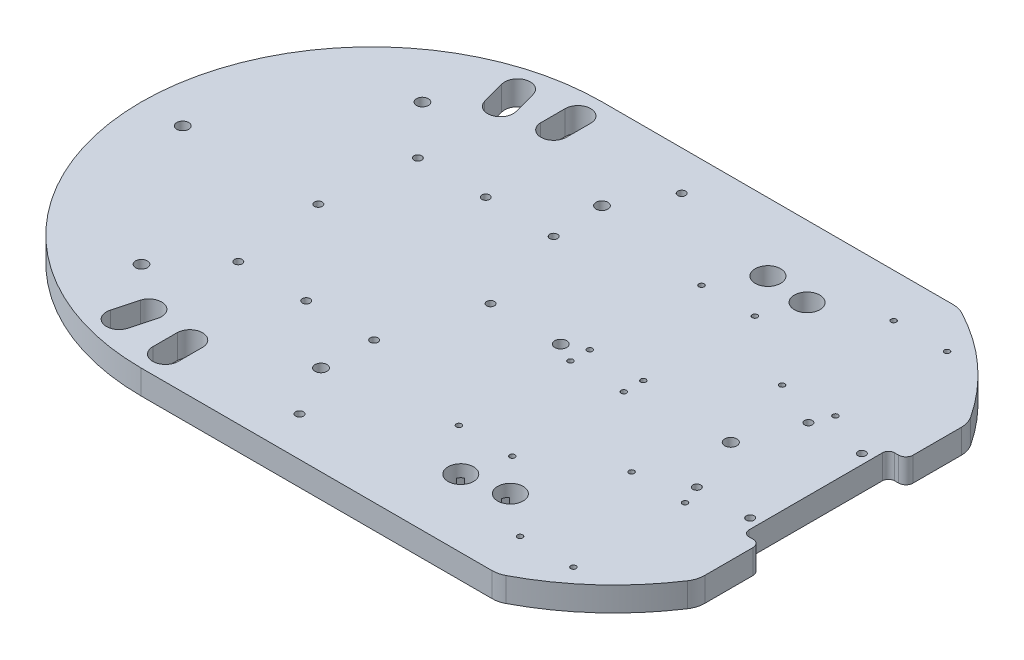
SolidWorks part; units mm, degrees
ref_plane "Plan de face" through (0, 0, 0) normal (0, 0, 1) x (1, 0, 0)
ref_plane "Plan de dessus" through (0, 0, 0) normal (0, 1, 0) x (1, 0, 0)
ref_plane "Plan de droite" through (0, 0, 0) normal (1, 0, 0) x (0, 0, -1)
sketch "Esquisse1" plane through (0, 0, 0) normal (0, 1, 0) x (1, 0, 0)
  line L0 (-177.9243, 0) -> (224.6136, 0) construction
  line L1 (0, -128.8397) -> (0, 232.2214) construction
  line L2 (-50, 153.4637) -> (-50, -108.2097) construction
  line L3 (-145, 153.4637) -> (-145, -16.1078) construction
  line L4 (-296.5055, -95) -> (165.0329, -95) construction
  line L5 (-296.5055, 95) -> (153.3586, 95) construction
  line L6 (-27.4378, -125) -> (224.6136, -125) construction
  line L7 (-16.4403, 125) -> (224.6136, 125) construction
  line L8 (50, 171.1415) -> (50, -142.5611) construction
  line L9 (145, 153.4637) -> (145, -16.1078) construction
  line L10 (175, 232.2214) -> (175, -16.1078) construction
  line L11 (140.1388, 52.8562) -> (140.1388, 32.9993)
  line L12 (-6, -128.8397) -> (-6, 131.9546) construction
  line L13 (-55.2475, -84.8379) -> (-55.2468, -74.8162)
  line L14 (140.1388, -52.8562) -> (140.1388, -32.9993)
  line L15 (-26, 113.4729) -> (-26, -11.8602) construction
  line L16 (-44.7532, -74.8163) -> (-44.7525, -84.8379)
  line L17 (-77.0263, -80.5889) -> (-74.4319, -70.909)
  line L18 (-64.2959, -73.6249) -> (-66.889, -83.3052)
  line L19 (-14, 101.3704) -> (-14, 44.8043) construction
  line L20 (-64.2959, 73.6249) -> (-66.889, 83.3052)
  line L21 (-77.0263, 80.5889) -> (-74.4319, 70.909)
  line L22 (-44.7532, 74.8163) -> (-44.7525, 84.8379)
  line L23 (-62.7409, 48) -> (-9.0687, 48) construction
  line L24 (-1, 101.3704) -> (-1, -104.4655) construction
  line L25 (140.1388, 33.3784) -> (140.1388, -104.4655) construction
  line L26 (-40.3664, 60) -> (-9.0687, 60) construction
  line L27 (-127.9, -4.9886) -> (-127.9, 16.0517) construction
  line L28 (-135.4235, -54) -> (58.496, -54) construction
  line L29 (-140.6207, 54) -> (70.9148, 54) construction
  line L30 (24, 71.1475) -> (24, -58.3385) construction
  line L31 (157.6514, -88) -> (74.6545, -88) construction
  line L32 (-28.8666, 32) -> (-9.0687, 32) construction
  line L33 (-124, 71.1475) -> (-124, -72.4444) construction
  line L34 (-55.2475, 84.8379) -> (-55.2468, 74.8162)
  line L35 (105, -142.5611) -> (105, 101.3704) construction
  line L36 (50, 67) -> (26.7379, 67) construction
  line L37 (46.3, 78.8772) -> (46.3, 61.2678) construction
  line L38 (-18, 41.9884) -> (-18, 25.784) construction
  line L39 (-12, 36.7593) -> (-12, 20.126) construction
  line L40 (-9.0687, 78.75) -> (10.6589, 78.75) construction
  line L41 (-50, -95) -> (94.6206, -95)
  line L42 (150.8973, -81) -> (91.6218, -81) construction
  line L43 (135.5, 30) -> (137.1388, 29.9993)
  line L44 (103, -31.9747) -> (103, 52.8138) construction
  line L45 (133, -100.0621) -> (133, 52.8027) construction
  line L46 (91.6218, -27) -> (153.3586, -27) construction
  line L47 (89.4913, 27) -> (153.3586, 27) construction
  line L48 (129, 16.0523) -> (129, 37.7103) construction
  line L49 (107, 16.0517) -> (107, 31.9992) construction
  line L50 (94.7599, 23) -> (137.2456, 23) construction
  line L51 (-133.0467, -57.9) -> (-60.0152, -57.9) construction
  line L52 (-87, -76.5245) -> (-87, -47.0651) construction
  line L53 (165.0329, 30) -> (126.8969, 30) construction
  line L54 (98, 8.4501) -> (98, -19.5582) construction
  line L55 (-50, 95) -> (94.6206, 95)
  line L56 (135.4993, -29.9993) -> (137.1388, -29.9993)
  line L57 (133, 27.5) -> (133, -27.5)
  line L58 (-12, -25.0379) -> (-12, -40.8443) construction
  line L59 (-40, -40.8443) -> (-40, -24.4452) construction
  line L60 (-7.7271, -32) -> (-79.35, -32) construction
  line L61 (-7.7271, -37) -> (-79.35, -37) construction
  line L62 (157.6514, -54) -> (76.4747, -54) construction
  line L65 (-72, -9.1158) -> (-72, 2.9834) construction
  line L66 (31.9201, 58.9632) -> (31.9201, -48.4837) construction
  line L67 (61.9201, -6.3536) -> (61.9201, 58.9632) construction
  line L68 (28.6394, 50) -> (70.9148, 50) construction
  line L69 (35.9201, 48) -> (35.9201, 57.9) construction
  line L70 (57.9201, 48) -> (57.9201, 57.9) construction
  line L71 (41.6352, 27) -> (70.9148, 27) construction
  line L72 (131.6616, -31) -> (72.8643, -31) construction
  line L73 (114.1388, -84.027) -> (114.1388, -25.0379) construction
  line L74 (84.1388, -81) -> (84.1388, -25.0379) construction
  line L75 (88.1388, -79.729) -> (88.1388, -28.7542) construction
  line L76 (110.1388, -78.75) -> (110.1388, -28.7542) construction
  arc A0 (50, -125) -> (50, 125) centre (50, 0) ccw construction
  arc A1 (50, -40) -> (50, 40) centre (50, 0) ccw construction
  arc A2 (50, -95) -> (50, 95) centre (50, 0) ccw construction
  arc A3 (-50, 95) -> (-50, -95) centre (-50, 0) ccw construction
  arc A4 (-64.2959, -73.6249) -> (-74.4319, -70.909) centre (-69.4114, -72.4444) ccw
  arc A5 (99.2686, 93.8542) -> (138.4866, 58.362) centre (50, 0) cw
  arc A6 (-50, 95) -> (-50, -95) centre (-50, 0) ccw
  circle A7 centre (-87, -57.9) radius 2.45
  arc A8 (-66.889, -83.3052) -> (-77.0263, -80.5889) centre (-71.9996, -82.1037) cw
  arc A9 (-44.7532, -74.8163) -> (-55.2468, -74.8162) centre (-50, -75) ccw
  circle A10 centre (70.9148, -63.7594) radius 5.25
  circle A11 centre (110.1388, -31) radius 1.1
  arc A12 (50, -67) -> (50, 67) centre (50, 0) ccw construction
  arc A13 (50, -94) -> (50, 94) centre (50, 0) ccw construction
  circle A14 centre (88.1388, 31) radius 1.1
  arc A15 (99.2686, -93.8542) -> (138.4866, -58.362) centre (50, 0) ccw
  circle A16 centre (-12, 37) radius 1.6
  arc A17 (140.1388, -32.9993) -> (137.1388, -29.9993) centre (137.1388, -32.9993) ccw
  arc A18 (140.1388, 32.9993) -> (137.1388, 29.9993) centre (137.1388, 32.9993) cw
  circle A19 centre (110.1388, 31) radius 1.1
  circle A20 centre (53.7, -67) radius 5.25
  circle A21 centre (88.1388, -31) radius 1.1
  circle A22 centre (-40, 37) radius 1.6
  circle A23 centre (-12, -37) radius 1.6
  circle A24 centre (-40, -37) radius 1.6
  circle A25 centre (-1, 78.75) radius 1.6
  circle A26 centre (-1, -78.75) radius 1.6
  circle A27 centre (-1, 0) radius 1.6
  circle A28 centre (88.1388, -77) radius 1.1
  circle A29 centre (-50, 0) radius 85 construction
  arc A30 (-44.7525, 84.8379) -> (-55.2475, 84.8379) centre (-50, 85) ccw
  arc A31 (-44.7532, 74.8163) -> (-55.2468, 74.8162) centre (-50, 75) cw
  arc A32 (-66.889, 83.3052) -> (-77.0263, 80.5889) centre (-71.9996, 82.1037) ccw
  arc A33 (-64.2959, 73.6249) -> (-74.4319, 70.909) centre (-69.4114, 72.4444) cw
  circle A34 centre (110.1388, -77) radius 1.1
  circle A35 centre (129, 23) radius 1.6
  circle A36 centre (107, 23) radius 1.6
  circle A37 centre (107, -23) radius 1.6
  circle A38 centre (129, -23) radius 1.6
  circle A39 centre (-127.9, 0) radius 2.45
  arc A40 (-44.7525, -84.8379) -> (-55.2475, -84.8379) centre (-50, -85) cw
  circle A41 centre (110.1388, 77) radius 1.1
  circle A42 centre (63.767, 65.6747) radius 5.25
  circle A43 centre (46.3, 67) radius 5.25
  circle A44 centre (117, 3.7) radius 5.25
  circle A45 centre (109.8737, -30.2957) radius 5.25
  circle A46 centre (115.6747, -13.767) radius 5.25
  circle A47 centre (106.1737, 36.7043) radius 5.25
  circle A48 centre (113.7594, 20.9148) radius 5.25
  circle A49 centre (27.9, 0) radius 2.45
  circle A50 centre (-13, -57.9) radius 2.45
  circle A51 centre (-13, 57.9) radius 2.45
  circle A52 centre (-87, 57.9) radius 2.45
  circle A53 centre (98, 0) radius 2.5
  circle A54 centre (88.1388, 77) radius 1.1
  arc A55 (140.1388, -52.8562) -> (138.4866, -58.362) centre (130.1388, -52.8562) cw
  arc A56 (135.4993, -29.9993) -> (133, -27.5) centre (135.4993, -27.5) cw
  arc A57 (135.5, 30) -> (133, 27.5) centre (135.5, 27.5) ccw
  arc A58 (99.2686, -93.8542) -> (94.6206, -95) centre (94.6206, -85) cw
  circle A59 centre (-68, -37) radius 1.6
  circle A60 centre (-68, 37) radius 1.6
  circle A61 centre (99.9924, -44.7599) radius 5.25
  circle A62 centre (94.7599, 49.9924) radius 5.25
  arc A63 (138.4866, 58.362) -> (140.1388, 52.8562) centre (130.1388, 52.8562) cw
  arc A64 (99.2686, 93.8542) -> (94.6206, 95) centre (94.6206, 85) ccw
  circle A65 centre (57.9201, 50) radius 1.1
  circle A66 centre (35.9201, 50) radius 1.1
  circle A67 centre (35.9201, 4) radius 1.1
  circle A68 centre (57.9201, 4) radius 1.1
  circle A69 centre (-72, 0) radius 1.6
  circle A70 centre (35.9201, -4) radius 1.1
  circle A71 centre (57.9201, -4) radius 1.1
  circle A72 centre (57.9201, -50) radius 1.1
  circle A73 centre (35.9201, -50) radius 1.1
  circle A74 centre (86.7043, -56.1737) radius 5.25
  circle A75 centre (80.2957, 59.8737) radius 5.25
  point P102 (140.1388, -88)
  point P139 (140.1388, -29.9993)
  point P212 (133, 30)
  point P238 (140.1388, -55.7763)
  point P282 (97.0213, -95)
  point P285 (140.1388, 55.7763)
  point P288 (97.0213, 95)
  dimension "D21" = 7
  dimension "D7" = 5
  dimension "D23" = 10
  dimension "D12" = 54
  dimension "D26" = 3.7
  dimension "D27" = 8
  dimension "D29" = 16.25
  dimension "D30" = 30
  dimension "D24" = 3
  dimension "D10" = 74
  dimension "D35" = 12
  dimension "D39" = 30
  dimension "D41" = 71
  dimension "D43" = 30
  dimension "D48" = 4
  dimension "D51" = 4
  dimension "D3" = 50
  dimension "D4" = 95
  dimension "D5" = 50
  dimension "D6" = 125
  dimension "D8" = 125
  dimension "D9" = 95
  dimension "D11" = 55
  dimension "D13" = 54
  dimension "D14" = 54
  dimension "D15" = 20
  dimension "D16" = 74
  dimension "D17" = 27
  dimension "D18" = 47
  dimension "D19" = 12
  dimension "D20" = 12
  dimension "D22" = 125
  dimension "D25" = 54
  dimension "D28" = 6
  dimension "D31" = 27
  dimension "D32" = 4
  dimension "D33" = 4
  dimension "D34" = 4
  dimension "D36" = 3.9
  dimension "D37" = 37
  dimension "D38" = 3.9
  dimension "D40" = 47
  dimension "D42" = 5
  dimension "D44" = 27
  dimension "D45" = 4
  dimension "D46" = 4
  dimension "D47" = 4
  dimension "D49" = 56
  dimension "D50" = 22
extrude "Extrusion1" add sketch "Esquisse1" along normal blind 10
sketch "Esquisse2" plane through (0, 0, 0) normal (0, -1, 0) x (1, 0, 0)
  line L0 (0, -106.0513) -> (0, 104.9663) construction
  line L1 (182.2671, 0) -> (-148.3633, 0) construction
  line L2 (-6, 104.9663) -> (-6, -106.0513) construction
  line L3 (-27.2959, -74.5) -> (17.3999, -74.5) construction
  line L5 (-27.2959, -37.25) -> (6.9354, -37.25) construction
  line L6 (6.9354, -62.25) -> (-9.3493, -62.25) construction
  line L7 (-1, 21.7412) -> (-1, -45.3861) construction
  line L8 (-6, -62.25) -> (4.1934, -52.0566) construction
  line L9 (-3.7373, -62.25) -> (1.7373, -62.25)
  line L10 (-3.7373, -12.25) -> (1.7373, -12.25)
  line L11 (-6, -14.5127) -> (-6, -59.9873)
  line L12 (4, -14.5127) -> (4, -59.9873)
  line L13 (4, 14.5127) -> (4, 59.9873)
  line L14 (-6, 14.5127) -> (-6, 59.9873)
  line L15 (-3.7373, 12.25) -> (1.7373, 12.25)
  line L16 (-3.7373, 62.25) -> (1.7373, 62.25)
  line L17 (50, 104.9663) -> (50, -111.0287) construction
  line L18 (42.3662, 40) -> (51.793, 40) construction
  line L19 (42.3662, 94) -> (51.793, 94) construction
  line L20 (-78.7789, 40) -> (13.0234, 40) construction
  line L21 (-78.7789, 34) -> (13.0234, 34) construction
  line L22 (-31.1646, 37) -> (13.0234, 37) construction
  line L24 (-26, 30.475) -> (-26, 44.2134) construction
  line L25 (-18, 44.2134) -> (-18, 28.1996) construction
  line L26 (-18, 34) -> (-32.8077, 48.8077) construction
  line L27 (-34, 36.2627) -> (-34, 37.7373)
  line L28 (-31.7373, 40) -> (-20.2627, 40)
  line L29 (-18, 37.7373) -> (-18, 36.2627)
  line L30 (-20.2627, 34) -> (-31.7373, 34)
  line L31 (-31.7373, -40) -> (-20.2627, -40)
  line L32 (-20.2627, -34) -> (-31.7373, -34)
  line L33 (-18, -37.7373) -> (-18, -36.2627)
  line L34 (-34, -36.2627) -> (-34, -37.7373)
  line L35 (47.4832, 93.2) -> (56.5838, 93.2) construction
  line L36 (48.2885, 40.8) -> (56.5838, 40.8) construction
  line L37 (49.2, 38.1388) -> (49.2, 97.736) construction
  line L38 (49.2, 93.2) -> (49.2, 40.8)
  line L39 (50.8, 40.8) -> (50.8, 93.2)
  line L40 (61.3326, 39.2027) -> (74.8947, 89.8172)
  line L41 (73.3492, 90.2313) -> (59.7871, 39.6168)
  line L47 (-42.1481, 48) -> (-10.4795, 48) construction
  line L48 (-75, 51.1976) -> (-75, -20.3552) construction
  line L49 (-40, 24.6064) -> (-40, 45.2704) construction
  line L50 (-12, 24.6064) -> (-12, 42.3834) construction
  line L51 (-59.7373, 34) -> (-48.2627, 34)
  line L52 (-62, 37.7373) -> (-62, 36.2627)
  line L53 (-48.2627, 40) -> (-59.7373, 40)
  line L54 (-46, 36.2627) -> (-46, 37.7373)
  line L55 (-46, -36.2627) -> (-46, -37.7373)
  line L56 (-48.2627, -40) -> (-59.7373, -40)
  line L57 (-62, -37.7373) -> (-62, -36.2627)
  line L58 (-14, 70.3573) -> (-14, 42.3834) construction
  line L59 (-31.7373, 60) -> (-19.1314, 60) construction
  line L60 (4, -82.8498) -> (4, 26.4676) construction
  line L65 (59.7871, -39.6168) -> (73.3492, -90.2313)
  line L66 (74.8947, -89.8172) -> (61.3326, -39.2027)
  line L67 (49.2, -40.8) -> (49.2, -93.2)
  line L68 (50.8, -93.2) -> (50.8, -40.8)
  line L69 (90.8, -0.8) -> (143.2, -0.8)
  line L70 (143.2, 0.8) -> (90.8, 0.8)
  line L71 (89.2027, -11.3326) -> (139.8172, -24.8947)
  line L72 (140.2313, -23.3492) -> (89.6168, -9.7871)
  line L73 (84.9338, -21.0928) -> (130.3136, -47.2928)
  line L74 (131.1136, -45.9072) -> (85.7338, -19.7072)
  line L75 (89.6168, 9.7871) -> (140.2313, 23.3492)
  line L76 (139.8172, 24.8947) -> (89.2027, 11.3326)
  line L77 (85.7338, 19.7072) -> (131.1136, 45.9072)
  line L78 (130.3136, 47.2928) -> (84.9338, 21.0928)
  line L79 (-59.7373, -34) -> (-48.2627, -34)
  line L80 (-135, 42.3834) -> (-135, -42.1958) construction
  line L81 (-85, 42.3834) -> (-85, -42.1958) construction
  line L82 (-147.021, -30) -> (-67.3448, -30) construction
  line L83 (-147.0125, 30) -> (-67.3363, 30) construction
  line L84 (-136.8837, -26) -> (-75.848, -26) construction
  line L85 (-131, -34) -> (-131, -20.3552) construction
  line L86 (-89, -34) -> (-89, -20.3552) construction
  line L87 (-145, -24.2641) -> (-145, 37.7373) construction
  line L88 (79.4156, 28.2843) -> (116.468, 65.3367)
  line L89 (115.3367, 66.468) -> (78.2843, 29.4156)
  line L90 (78.2843, -29.4156) -> (115.3367, -66.468)
  line L91 (116.468, -65.3367) -> (79.4156, -28.2843)
  line L92 (71.0928, 34.9338) -> (97.2928, 80.3136)
  line L93 (95.9072, 81.1136) -> (69.7072, 35.7338)
  line L94 (69.7072, -35.7338) -> (95.9072, -81.1136)
  line L95 (97.2928, -80.3136) -> (71.0928, -34.9338)
  arc A0 (-6, -59.9873) -> (-3.7373, -62.25) centre (-4.8686, -61.1186) ccw
  arc A1 (4, -14.5127) -> (1.7373, -12.25) centre (2.8686, -13.3814) ccw
  arc A2 (-6, -14.5127) -> (-3.7373, -12.25) centre (-4.8686, -13.3814) cw
  arc A3 (4, -59.9873) -> (1.7373, -62.25) centre (2.8686, -61.1186) cw
  arc A4 (-6, 14.5127) -> (-3.7373, 12.25) centre (-4.8686, 13.3814) ccw
  arc A5 (4, 14.5127) -> (1.7373, 12.25) centre (2.8686, 13.3814) cw
  arc A6 (-6, 59.9873) -> (-3.7373, 62.25) centre (-4.8686, 61.1186) cw
  arc A7 (4, 59.9873) -> (1.7373, 62.25) centre (2.8686, 61.1186) ccw
  arc A8 (59.7871, 39.6168) -> (61.3326, 39.2027) centre (60.5598, 39.4098) ccw
  arc A9 (-20.2627, 34) -> (-18, 36.2627) centre (-19.1314, 35.1314) ccw
  arc A10 (-20.2627, 40) -> (-18, 37.7373) centre (-19.1314, 38.8686) cw
  arc A11 (-31.7373, 34) -> (-34, 36.2627) centre (-32.8686, 35.1314) cw
  arc A12 (-31.7373, 40) -> (-34, 37.7373) centre (-32.8686, 38.8686) ccw
  arc A13 (-31.7373, -34) -> (-34, -36.2627) centre (-32.8686, -35.1314) ccw
  arc A14 (-31.7373, -40) -> (-34, -37.7373) centre (-32.8686, -38.8686) cw
  arc A15 (-20.2627, -40) -> (-18, -37.7373) centre (-19.1314, -38.8686) ccw
  arc A16 (-20.2627, -34) -> (-18, -36.2627) centre (-19.1314, -35.1314) cw
  arc A17 (49.2, 40.8) -> (50.8, 40.8) centre (50, 40.8) ccw
  arc A18 (50.8, 93.2) -> (49.2, 93.2) centre (50, 93.2) ccw
  arc A19 (74.8947, 89.8172) -> (73.3492, 90.2313) centre (74.1219, 90.0243) ccw
  arc A24 (-48.2627, 40) -> (-46, 37.7373) centre (-47.1314, 38.8686) cw
  circle A25 centre (-14, 48) radius 1.1
  circle A26 centre (-14, 72) radius 1.1
  arc A27 (-48.2627, 34) -> (-46, 36.2627) centre (-47.1314, 35.1314) ccw
  arc A28 (-59.7373, 40) -> (-62, 37.7373) centre (-60.8686, 38.8686) ccw
  arc A29 (-59.7373, 34) -> (-62, 36.2627) centre (-60.8686, 35.1314) cw
  arc A30 (-59.7373, -34) -> (-62, -36.2627) centre (-60.8686, -35.1314) ccw
  arc A31 (-59.7373, -40) -> (-62, -37.7373) centre (-60.8686, -38.8686) cw
  arc A32 (-48.2627, -34) -> (-46, -36.2627) centre (-47.1314, -35.1314) cw
  arc A33 (-48.2627, -40) -> (-46, -37.7373) centre (-47.1314, -38.8686) ccw
  circle A34 centre (-131, -26) radius 1.1
  circle A35 centre (-89, -26) radius 1.1
  circle A37 centre (-38, 48) radius 1.1
  circle A38 centre (-38, 72) radius 1.1
  circle A39 centre (-38, -72) radius 1.1
  circle A40 centre (-38, -48) radius 1.1
  circle A41 centre (-14, -72) radius 1.1
  circle A42 centre (-14, -48) radius 1.1
  arc A46 (61.3326, -39.2027) -> (59.7871, -39.6168) centre (60.5598, -39.4098) ccw
  arc A47 (73.3492, -90.2313) -> (74.8947, -89.8172) centre (74.1219, -90.0243) ccw
  arc A48 (50.8, -40.8) -> (49.2, -40.8) centre (50, -40.8) ccw
  arc A49 (49.2, -93.2) -> (50.8, -93.2) centre (50, -93.2) ccw
  arc A50 (90.8, 0.8) -> (90.8, -0.8) centre (90.8, 0) ccw
  arc A51 (143.2, -0.8) -> (143.2, 0.8) centre (143.2, 0) ccw
  arc A52 (89.6168, -9.7871) -> (89.2027, -11.3326) centre (89.4098, -10.5598) ccw
  arc A53 (85.7338, -19.7072) -> (84.9338, -21.0928) centre (85.3338, -20.4) ccw
  arc A54 (130.3136, -47.2928) -> (131.1136, -45.9072) centre (130.7136, -46.6) ccw
  arc A55 (139.8172, -24.8947) -> (140.2313, -23.3492) centre (140.0243, -24.1219) ccw
  arc A56 (89.2027, 11.3326) -> (89.6168, 9.7871) centre (89.4098, 10.5598) ccw
  arc A57 (84.9338, 21.0928) -> (85.7338, 19.7072) centre (85.3338, 20.4) ccw
  arc A58 (131.1136, 45.9072) -> (130.3136, 47.2928) centre (130.7136, 46.6) ccw
  arc A59 (140.2313, 23.3492) -> (139.8172, 24.8947) centre (140.0243, 24.1219) ccw
  circle A60 centre (-131, 26) radius 1.1
  circle A61 centre (-89, 26) radius 1.1
  arc A62 (78.2843, 29.4156) -> (79.4156, 28.2843) centre (78.85, 28.85) ccw
  arc A63 (116.468, 65.3367) -> (115.3367, 66.468) centre (115.9023, 65.9024) ccw
  arc A64 (115.3367, -66.468) -> (116.468, -65.3367) centre (115.9024, -65.9023) ccw
  arc A65 (79.4156, -28.2843) -> (78.2843, -29.4156) centre (78.85, -28.85) ccw
  arc A66 (69.7072, 35.7338) -> (71.0928, 34.9338) centre (70.4, 35.3338) ccw
  arc A67 (97.2928, 80.3136) -> (95.9072, 81.1136) centre (96.6, 80.7136) ccw
  arc A68 (71.0928, -34.9338) -> (69.7072, -35.7338) centre (70.4, -35.3338) ccw
  arc A69 (95.9072, -81.1136) -> (97.2928, -80.3136) centre (96.6, -80.7136) ccw
  dimension "D7" = 50
  dimension "D8" = 40
  dimension "D14" = 8
  dimension "D16" = 0.8
  dimension "D23" = 60
  dimension "D2" = 37.25
  dimension "D3" = 10
  dimension "D4" = 5
  dimension "D5" = 25
  dimension "D6" = 45
  dimension "D9" = 54
  dimension "D11" = 6
  dimension "D12" = 3
  dimension "D13" = 69
  dimension "D15" = 45
  dimension "D17" = 0.8
  dimension "D18" = 0.8
  dimension "D22" = 12
  dimension "D24" = 50
  dimension "D25" = 4
  dimension "D26" = 4
  dimension "D27" = 4
  dimension "D28" = 10
  dimension "D29" = 30
extrude "Enlèv. mat.-Extru.1" cut sketch "Esquisse2" against normal blind 5
